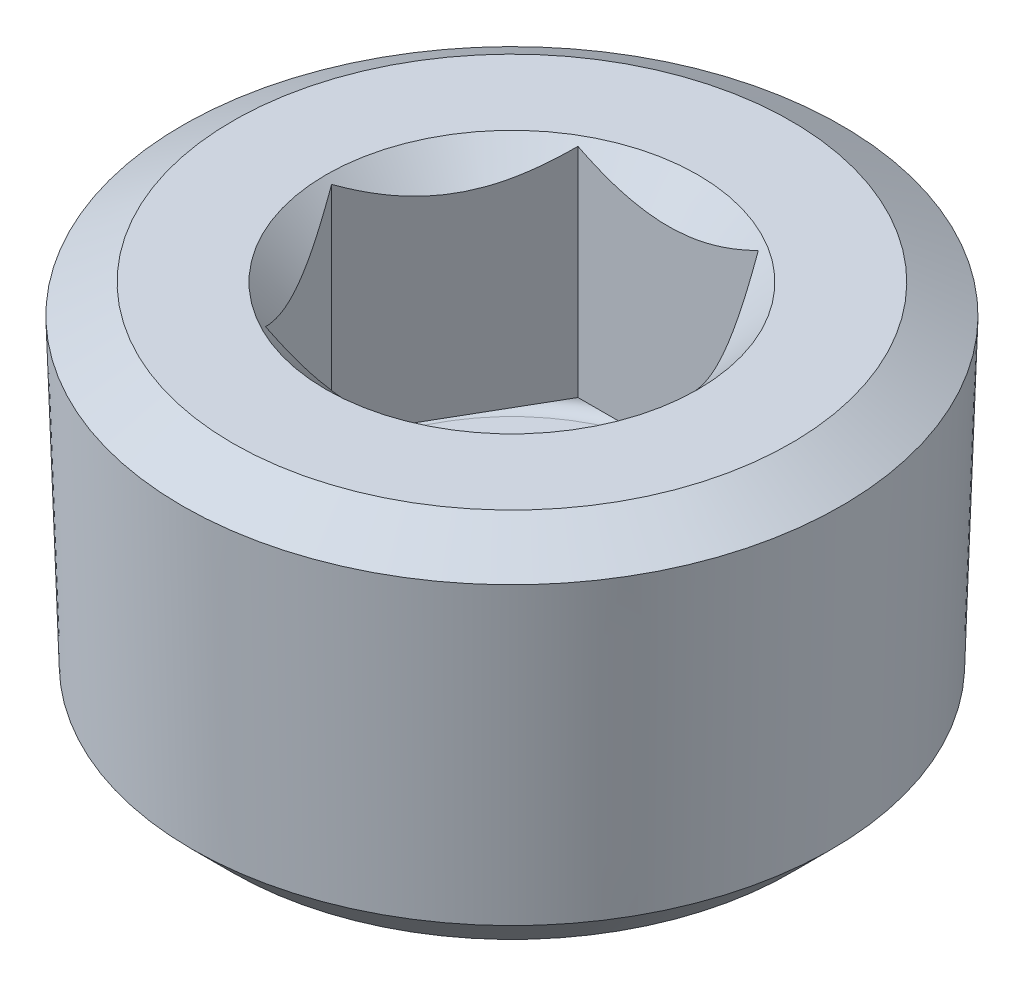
SolidWorks part; units mm, degrees
ref_plane "Front Plane" through (0, 0, 0) normal (0, 0, 1) x (1, 0, 0)
ref_plane "Top Plane" through (0, 0, 0) normal (0, 1, 0) x (1, 0, 0)
ref_plane "Right Plane" through (0, 0, 0) normal (1, 0, 0) x (0, 0, -1)
sketch "Sketch2" plane through (0, 0, 0) normal (0, 0, 1) x (1, 0, 0)
  line L0 (0, 10.7443) -> (0, -17.0657) construction
  line L1 (0, 0) -> (-14.3024, 0)
  line L2 (-16.8826, -1.4897) -> (-16.3999, -16.9525)
  line L3 (-14.3024, -19.05) -> (0, -19.05)
  line L4 (0, -19.05) -> (0, 0)
  line L6 (-14.3024, -19.05) -> (-16.3999, -16.9525)
  line L7 (-14.3024, 0) -> (-16.8826, -1.4897)
  point P4 (-16.9291, 0)
  point P6 (-16.3344, -19.05)
  dimension "D1" = 19.05
  dimension "D2" = 1.788
  dimension "D3" = 33.8582
  dimension "D4" = 30
  dimension "D5" = 2.032
  dimension "D6" = 45
revolve "Revolve1" add sketch "Sketch2" angle 360 about L0
sketch "Sketch3" plane through (0, 0, 0) normal (0, 0, 1) x (1, 0, 0)
  line L0 (0, 2.9342) -> (0, -18.7525) construction
  line L1 (0, 0) -> (-9.525, 0)
  line L2 (14.3024, 0) -> (-14.3024, 0) construction
  line L3 (-8.001, -1.524) -> (-8.001, -11.43)
  line L4 (-9.525, -12.7) -> (0, -12.7)
  line L5 (0, -12.7) -> (0, 0)
  line L6 (-8.001, -1.524) -> (-9.525, 0)
  line L7 (-8.001, -11.43) -> (-9.525, -11.43)
  arc A0 (-9.525, -11.43) -> (-9.525, -12.7) centre (-9.525, -12.065) ccw
  dimension "D1" = 11.43
  dimension "D2" = 12.7
  dimension "D3" = 16.002
  dimension "D4" = 1.524
  dimension "D5" = 45
  dimension "D6" = 1.524
revolve "Cut-Revolve1" cut sketch "Sketch3" angle 360 about L0
sketch "Sketch4" plane through (0, 0, 0) normal (0, 1, 0) x (1, 0, 0)
  line L1 (-4.6194, -8.001) -> (4.6194, -8.001)
  line L2 (4.6194, -8.001) -> (9.2388, 0)
  line L3 (9.2388, 0) -> (4.6194, 8.001)
  line L4 (4.6194, 8.001) -> (-4.6194, 8.001)
  line L5 (-4.6194, 8.001) -> (-9.2388, 0)
  line L6 (-9.2388, 0) -> (-4.6194, -8.001)
  circle A0 centre (0, 0) radius 8.001 construction
  circle A1 centre (0, 0) radius 8.001 construction
extrude "Cut-Extrude1" cut sketch "Sketch4" against normal up to vertex (5.2929 mm away)
